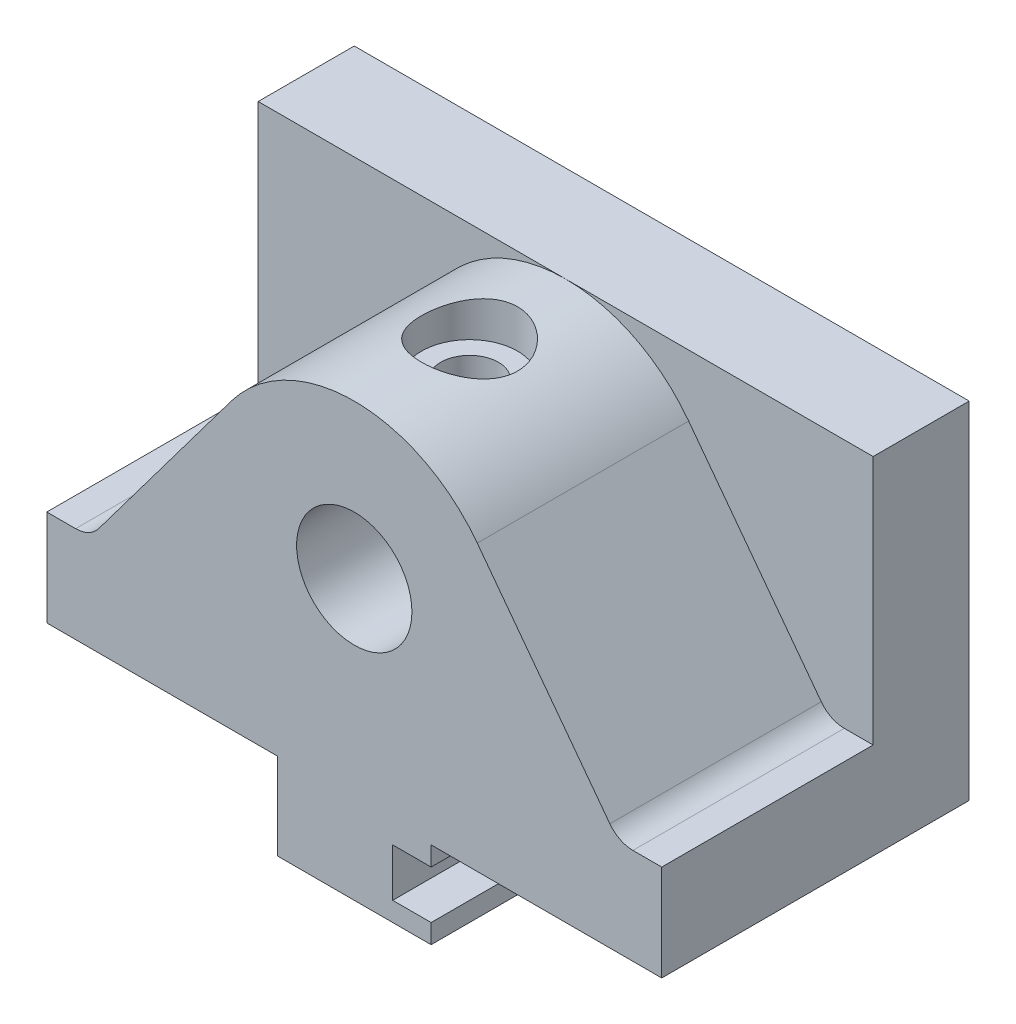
SolidWorks part; units mm, degrees
ref_plane "Front" through (0, 0, 0) normal (0, 0, 1) x (1, 0, 0)
ref_plane "Top" through (0, 0, 0) normal (0, 1, 0) x (1, 0, 0)
ref_plane "Right" through (0, 0, 0) normal (1, 0, 0) x (0, 0, -1)
sketch "Sketch1" plane through (0, 0, 0) normal (0, 0, 1) x (1, 0, 0)
  line L0 (0, 35.7198) -> (0, -31.9855) construction
  line L1 (-32, 22) -> (32, 22)
  line L2 (32, 22) -> (32, -14)
  line L3 (32, -14) -> (8, -14)
  line L4 (8, -14) -> (8, -23)
  line L5 (8, -23) -> (-8, -23)
  line L6 (-8, -14) -> (-8, -23)
  line L7 (-32, -14) -> (-8, -14)
  line L8 (-32, 22) -> (-32, -14)
  point P10 (0, -23)
  point P13 (0, 22)
  dimension "D1" = 64
  dimension "D2" = 36
  dimension "D3" = 9
  dimension "D4" = 16
  dimension "D5" = 23
extrude "Extrude1" add sketch "Sketch1" along normal blind 32
sketch "Sketch2" plane through (0, 0, 32) normal (0, 0, 1) x (1, 0, 0)
  line L0 (12.8, 15.6) -> (27.5, -4)
  line L1 (27.5, -4) -> (32, -4)
  line L2 (32, -14) -> (32, 22) construction
  line L3 (32, 22) -> (-32, 22) construction
  line L4 (0, 30.4947) -> (0, -33.3559) construction
  line L5 (-27.5, -4) -> (-32, -4)
  line L6 (-12.8, 15.6) -> (-27.5, -4)
  line L7 (8, -14) -> (32, -14) construction
  line L8 (-32, -4) -> (-34.9332, -4)
  line L9 (-34.9332, -4) -> (-34.9332, 29.2569)
  line L10 (-34.9332, 29.2569) -> (38.9733, 29.2569)
  line L11 (38.9733, 29.2569) -> (38.9733, -4)
  line L12 (38.9733, -4) -> (32, -4)
  arc A0 (-12.8, 15.6) -> (12.8, 15.6) centre (0, 6) cw
  dimension "D1" = 16
  dimension "D2" = 55
  dimension "D3" = 10
extrude "Cut-Extrude1" cut sketch "Sketch2" against normal blind 22
fillet "Fillet1" radius 3
other "Hole1" parameters "D1"=24
sketch "Sketch3" plane through (0, 0, 32) normal (0, 0, 1) x (1, 0, 0)
  circle A0 centre (0, 6) radius 6
  arc A1 (12.8, 15.6) -> (-12.8, 15.6) centre (0, 6) ccw construction
  dimension "D1" = 12
hole_wizard "CBORE for M3 SBHCS1" positions "3DSketch2" profile "Sketch5" counterbore size "M3" standard "Ansi Metric"
sketch3d "3DSketch2"
  line L0 (32, 22, 0) -> (-32, 22, 0) construction
  line L2 (32, 22, 10) -> (32, 22, 0) construction
  point P0 (0, 22, 20)
  dimension "D1" = 20
  dimension "D2" = 32
sketch "Sketch5" plane through (0, 22, 20) normal (1, 0, 0) x (0, 0, 1)
  line L0 (0, 0) -> (0, 10)
  line L1 (0, 10) -> (3, 10)
  line L3 (3, 10) -> (3, 4)
  line L4 (3, 4) -> (5, 4)
  line L5 (5, 4) -> (5, 0)
  line L7 (5, 0) -> (0, 0)
  line L11 (0, -6.35) -> (0, 107.95) construction
  dimension "Thru Hole Dia." = 6
  dimension "Thru Hole Depth" = 10
  dimension "C'Bore Dia." = 10
  dimension "C'Bore Depth" = 4
ref_plane "Plane1" through (0, 0, 24) normal (0, 0, 1) x (1, 0, 0)
sketch "Sketch6" plane through (0, 0, 24) normal (0, 0, 1) x (1, 0, 0)
  line L0 (0, 32.955) -> (0, -32.955) construction
  line L1 (0, -23) -> (3, -23)
  line L2 (-8, -23) -> (8, -23) construction
  line L3 (3, -23) -> (3, -7)
  line L4 (3, -7) -> (0, -5.2679)
  line L5 (0, -5.2679) -> (0, -23)
  dimension "D1" = 16
  dimension "D2" = 6
  dimension "D3" = 60
revolve "Cut-Revolve1" cut sketch "Sketch6" angle 360 about L0
pattern_linear "LPattern1" count 2 spacing 16
sketch "Sketch8" plane through (0, 0, 32) normal (0, 0, 1) x (1, 0, 0)
  line L0 (8, -23) -> (8, -14) construction
  line L1 (8, -16) -> (4, -16)
  line L2 (8, -16) -> (8, -21)
  line L3 (8, -21) -> (4, -21)
  line L4 (4, -16) -> (4, -21)
  line L5 (-8, -23) -> (8, -23) construction
  dimension "D1" = 4
  dimension "D2" = 5
  dimension "D3" = 2
extrude "Cut-Extrude2" cut sketch "Sketch8" against normal through all
